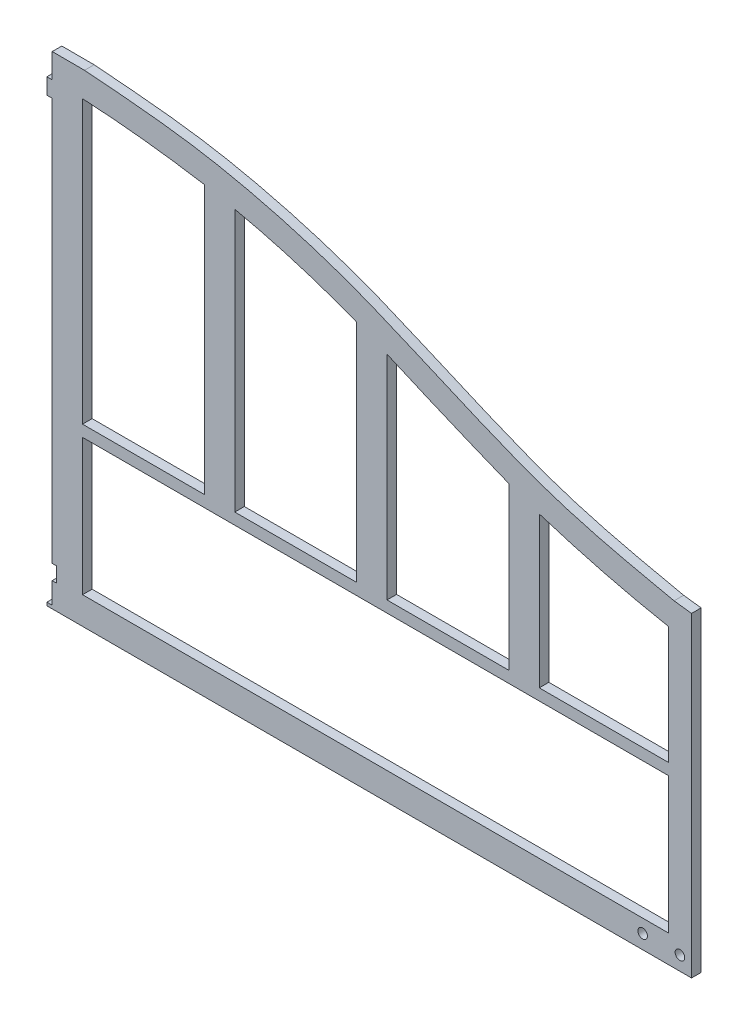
SolidWorks part; units mm, degrees
ref_plane "Plan de face" through (0, 0, 0) normal (0, 0, 1) x (1, 0, 0)
ref_plane "Plan de dessus" through (0, 0, 0) normal (0, 1, 0) x (1, 0, 0)
ref_plane "Plan de droite" through (0, 0, 0) normal (1, 0, 0) x (0, 0, -1)
sketch "Esquisse1" plane through (0, 0, 0) normal (0, 0, 1) x (1, 0, 0)
  line L0 (0, 0) -> (605, 0)
  line L1 (0, 0) -> (0, 3)
  line L2 (0, 3) -> (5, 3)
  line L3 (5, 3) -> (5, 23)
  line L4 (5, 23) -> (9, 23)
  line L5 (9, 23) -> (9, 37)
  line L6 (9, 37) -> (5, 37)
  line L7 (5, 37) -> (5, 415)
  line L8 (5, 415) -> (0, 415)
  line L9 (0, 415) -> (0, 430)
  line L10 (0, 430) -> (5, 430)
  line L11 (5, 430) -> (5, 453)
  line L12 (605, 0) -> (605, 296.33)
  line L13 (33.46, 25.76) -> (583.6, 25.76)
  line L14 (33.46, 25.76) -> (33.46, 153.66)
  line L15 (33.46, 153.66) -> (583.6, 153.66)
  line L16 (583.6, 25.76) -> (583.6, 153.66)
  line L17 (35.3291, 452.9273) -> (5, 453)
  line L18 (33.46, 164.37) -> (147.88, 164.37)
  line L19 (33.46, 164.37) -> (33.46, 428.94)
  line L20 (588.6191, 298.3764) -> (605, 296.33)
  line L21 (147.88, 164.37) -> (147.88, 416.25)
  line L22 (176.34, 164.37) -> (290.76, 164.37)
  line L23 (176.34, 164.37) -> (176.34, 410.53)
  line L25 (290.76, 164.37) -> (290.76, 375.89)
  line L26 (319.22, 164.37) -> (433.64, 164.37)
  line L27 (319.22, 164.37) -> (319.22, 364.15)
  line L29 (433.64, 164.37) -> (433.64, 316.11)
  line L30 (462.1, 164.37) -> (583.58, 164.37)
  line L31 (462.1, 164.37) -> (462.1, 305.76)
  line L33 (583.58, 164.37) -> (583.58, 274.85)
  arc A0 (33.46, 428.94) -> (147.88, 416.25) centre (-23.1208, -603.4054) cw
  arc A1 (176.34, 410.53) -> (290.76, 375.89) centre (20.3928, -310.8733) cw
  arc A2 (462.1, 305.76) -> (583.58, 274.85) centre (775.4197, 1282.9734) ccw
  arc A3 (319.22, 364.15) -> (433.64, 316.11) centre (1744.5508, 3598.6724) ccw
  circle A4 centre (594.14, 13.26) radius 4.5
  circle A5 centre (559.14, 13.26) radius 4.5
  spline S2 degree 3 poles (35.3291, 452.9273) (41.3224, 452.4603) (53.2824, 451.5284) (71.3755, 450.0323) (89.543, 448.3555) (107.7893, 446.4084) (126.0973, 444.099) (144.4506, 441.3419) (162.8458, 438.0181) (180.9692, 434.2147) (198.9593, 430.0387) (222.8703, 423.9316) (246.5896, 417.011) (270.0694, 409.2357) (287.5288, 402.9775) (304.8754, 396.2471) (321.8206, 389.2092) (338.433, 382.1178) (360.4884, 372.606) (387.8488, 360.7549) (415.1008, 349.3049) (436.9172, 340.5974) (453.3128, 334.3312) (469.5479, 328.5405) (491.335, 321.567) (519.2676, 313.9097) (547.8706, 307.2184) (571.0579, 302.1379) (582.7747, 299.6282) (588.6191, 298.3764) knots 0 0 0 0 0.03125 0.0625 0.09375 0.125 0.15625 0.1875 0.21875 0.25 0.28125 0.3125 0.375 0.40625 0.4375 0.46875 0.5 0.53125 0.5625 0.625 0.6875 0.71875 0.75 0.78125 0.8125 0.875 0.9375 0.96875 1 1 1 1
  dimension "D33" = 1033.8947
  dimension "D34" = 738.0665
  dimension "D35" = 3534.6432
  dimension "D36" = 1026.2141
  dimension "D37" = 9
  dimension "D38" = 9
  dimension "D40" = 10.86
  dimension "D41" = 13.26
  dimension "D1" = 605
  dimension "D2" = 3
  dimension "D3" = 5
  dimension "D4" = 20
  dimension "D5" = 4
  dimension "D6" = 14
  dimension "D7" = 378
  dimension "D8" = 5
  dimension "D9" = 15
  dimension "D10" = 5
  dimension "D11" = 23
  dimension "D12" = 296.33
  dimension "D13" = 25.76
  dimension "D14" = 28.46
  dimension "D15" = 550.14
  dimension "D16" = 127.9
  dimension "D17" = 10.71
  dimension "D18" = 114.42
  dimension "D19" = 264.57
  dimension "D20" = 251.88
  dimension "D21" = 28.46
  dimension "D22" = 114.42
  dimension "D23" = 246.16
  dimension "D24" = 211.52
  dimension "D25" = 28.46
  dimension "D26" = 114.42
  dimension "D27" = 199.78
  dimension "D28" = 151.74
  dimension "D29" = 28.46
  dimension "D30" = 121.48
  dimension "D31" = 141.39
  dimension "D32" = 110.48
  dimension "D39" = 35
extrude "Extrusion1" add sketch "Esquisse1" along normal blind 9
